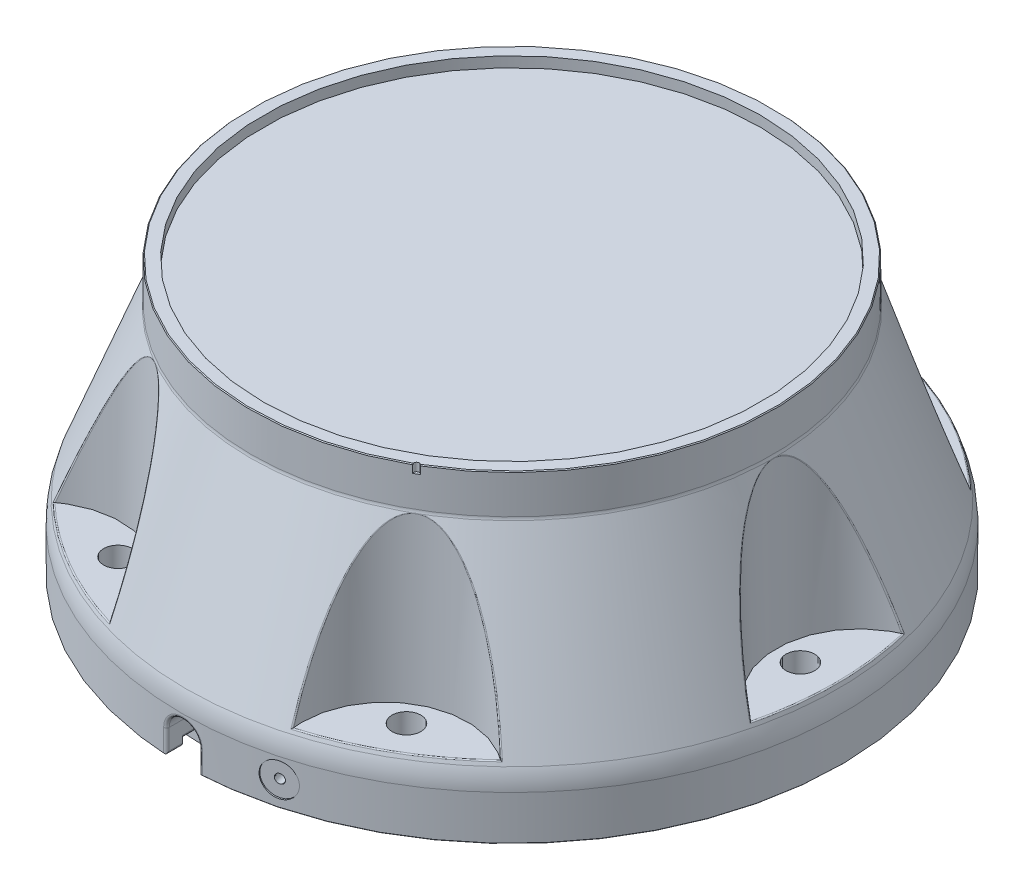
SolidWorks part; units mm, degrees
other "圆角17"
ref_plane "前视基准面" through (0, 0, 0) normal (0, 0, 1) x (1, 0, 0)
ref_plane "上视基准面" through (0, 0, 0) normal (0, 1, 0) x (1, 0, 0)
ref_plane "右视基准面" through (0, 0, 0) normal (1, 0, 0) x (0, 0, -1)
imported_body "输入1"
sketch "草图1" plane through (0, 96, 0) normal (0, 1, 0) x (1, 0, 0)
  circle A0 centre (0, 0) radius 90.5
extrude "凸台-拉伸1" add sketch "草图1" against normal blind 10
sketch "草图4" plane through (0, 84, 0) normal (0, -1, 0) x (1, 0, 0)
  circle A0 centre (0, 0) radius 85.8665
extrude "凸台-拉伸2" add sketch "草图4" along normal up to surface (84 mm away)
sketch "草图5" plane through (0, 0, 0) normal (0, -1, 0) x (1, 0, 0)
  line L6 (43.4199, -74.0795) -> (43.8262, -74.7965)
  arc A9 (81.2408, -74.1616) -> (45.0998, -74.1151) centre (63.125, -109.3357) ccw construction
  arc A10 (44.5118, -73.4286) -> (85.1718, -10.9008) centre (0, 0) ccw construction
  arc A11 (85.1718, -10.9008) -> (103.8923, -36.1439) centre (126.25, 0) ccw construction
  arc A12 (81.4389, -73.9439) -> (103.7963, -36.4188) centre (0, 0) ccw construction
  arc A13 (81.2408, -74.1616) -> (43.8262, -74.7965) centre (63.125, -109.3357) ccw
  arc A14 (43.4199, -74.0795) -> (85.1718, -10.9008) centre (0, 0) ccw
  arc A15 (85.1718, -10.9008) -> (103.8923, -36.1439) centre (126.25, 0) ccw
  arc A16 (81.2408, -74.1616) -> (103.8923, -36.1439) centre (0, 0) ccw
extrude "凸台-拉伸3" add sketch "草图5" against normal up to surface (106.6046 mm away)
pattern_circular "阵列(圆周)1" count 6 over 360 about axis through (0, 0, 0) along (0, 1, 0) of "凸台-拉伸3"
sketch "草图6" plane through (0, 0, 0) normal (0, -1, 0) x (1, 0, 0)
  line L0 (46.6654, -76.8353) -> (33.3267, -69.8244)
  line L1 (33.3267, -69.8244) -> (16.2847, -109.3357)
  line L2 (16.2847, -109.3357) -> (28.5732, -111.2567)
  line L3 (28.5732, -111.2567) -> (37.2926, -84.8069)
  line L4 (37.2926, -84.8069) -> (46.6654, -76.8353)
  line L5 (-89.0916, -65.1505) -> (-81.3739, -78.7474)
  line L6 (-81.3739, -78.7474) -> (-43.8393, -76.8353)
  line L7 (-43.8393, -76.8353) -> (-39.3778, -65.1505)
  line L8 (-39.3778, -65.1505) -> (-89.0916, -65.1505)
  line L9 (-28.5447, 100.8223) -> (-45.8619, 75.1038)
  line L10 (-45.8619, 75.1038) -> (-36.5956, 68.8645)
  line L11 (-36.5956, 68.8645) -> (-19.2785, 94.583)
  line L12 (-19.2785, 94.583) -> (-20.7919, 102.3358)
  line L13 (-20.7919, 102.3358) -> (-28.5447, 100.8223)
  line L14 (38.0508, 75.1038) -> (83.5657, 75.1038)
  line L15 (83.5657, 75.1038) -> (86.6474, 69.9429)
  line L16 (86.6474, 69.9429) -> (55.0598, 58.0823)
  line L17 (55.0598, 58.0823) -> (38.0508, 75.1038)
  arc A14 (33.3267, 112.8089) -> (81.032, 85.2662) centre (63.125, 109.3357) ccw construction
extrude "凸台-拉伸4" add sketch "草图6" against normal up to surface (33.3453 mm away)
sketch "草图7" plane through (0, 96, 0) normal (0, 1, 0) x (1, 0, 0)
  circle A1 centre (0, 0) radius 90.5
extrude "切除-拉伸1" cut sketch "草图7" along normal through all
other "删除面1"
